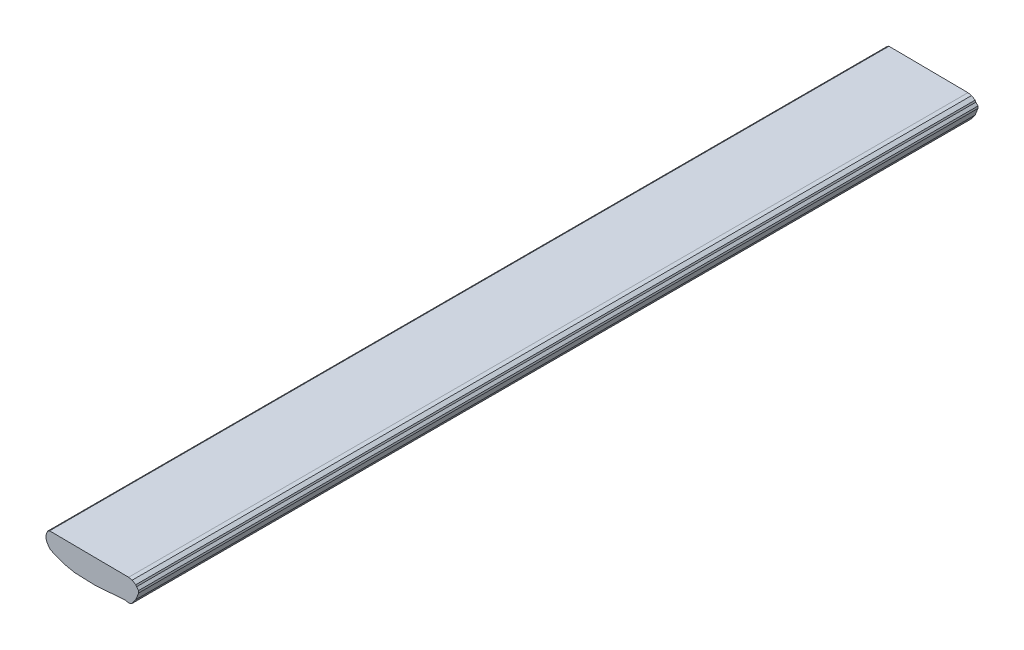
SolidWorks part; units mm, degrees
ref_plane "Front Plane" through (0, 0, 0) normal (0, 0, 1) x (1, 0, 0)
ref_plane "Top Plane" through (0, 0, 0) normal (0, 1, 0) x (1, 0, 0)
ref_plane "Right Plane" through (0, 0, 0) normal (1, 0, 0) x (0, 0, -1)
ref_plane "Plane1" through (0, 0, 8.4) normal (0, 0, 1) x (1, 0, 0)
sketch "Sketch1" plane through (0, 0, 8.4) normal (0, 0, 1) x (1, 0, 0)
  line L0 (572, 148) -> (570, 142)
  line L1 (570, 142) -> (570, 138)
  line L2 (570, 138) -> (571, 135)
  line L3 (571, 135) -> (574, 130)
  line L4 (574, 130) -> (576, 128)
  line L5 (576, 128) -> (580, 126)
  line L6 (580, 126) -> (585, 124)
  line L7 (585, 124) -> (596, 120)
  line L8 (596, 120) -> (610, 117)
  line L9 (610, 117) -> (637, 116)
  line L10 (637, 116) -> (681, 119)
  line L11 (681, 119) -> (685, 118)
  line L12 (685, 118) -> (689, 119)
  line L13 (689, 119) -> (695, 127)
  line L14 (695, 127) -> (699, 137)
  line L15 (699, 137) -> (699, 140)
  line L16 (699, 140) -> (696, 143)
  line L17 (696, 143) -> (695, 145)
  line L18 (695, 145) -> (690, 148)
  line L19 (690, 148) -> (685, 149)
  line L20 (685, 149) -> (575, 150)
  line L21 (575, 150) -> (572, 148)
extrude "Extrude1" add sketch "Sketch1" against normal blind 1168.4
